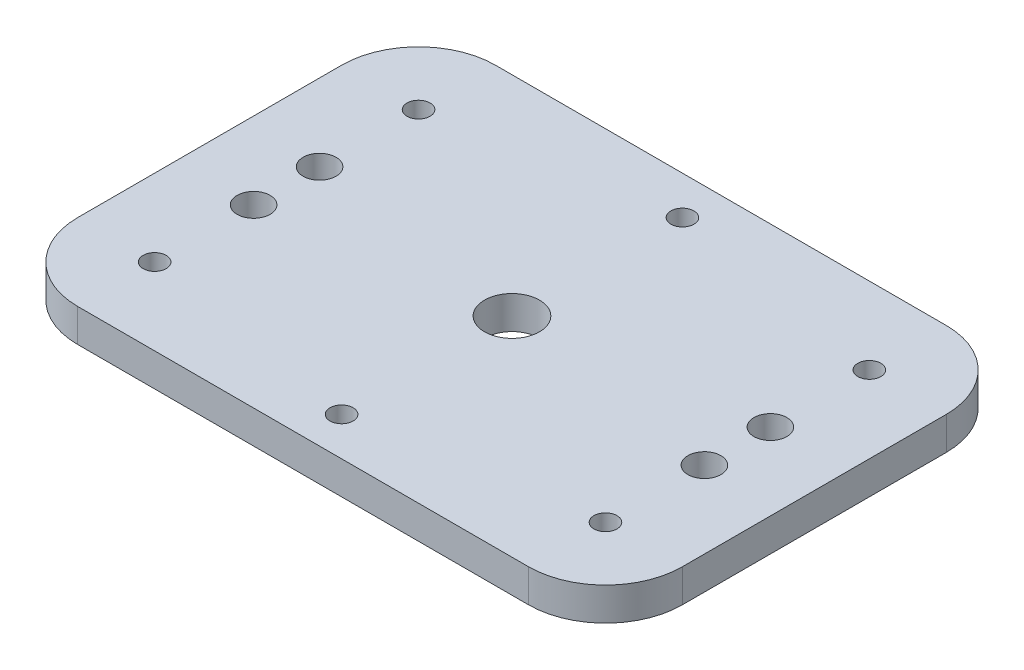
SolidWorks part; units mm, degrees
ref_plane "Front Plane" through (0, 0, 0) normal (0, 0, 1) x (1, 0, 0)
ref_plane "Top Plane" through (0, 0, 0) normal (0, 1, 0) x (1, 0, 0)
ref_plane "Right Plane" through (0, 0, 0) normal (1, 0, 0) x (0, 0, -1)
sketch "Sketch1" plane through (0, 0, 0) normal (0, 1, 0) x (1, 0, 0)
  line L0 (0, 38) -> (110, 38) construction
  line L1 (14, 0) -> (96, 0)
  line L2 (0, 14) -> (0, 62)
  line L3 (14, 76) -> (96, 76)
  line L4 (110, 14) -> (110, 62)
  line L5 (14, 62) -> (14, 44) construction
  line L6 (14, 44) -> (14, 32) construction
  line L7 (14, 32) -> (14, 14) construction
  line L8 (96, 62) -> (96, 44) construction
  line L9 (96, 44) -> (96, 32) construction
  line L10 (96, 32) -> (96, 14) construction
  line L11 (55, 76) -> (55, 0) construction
  line L12 (14, 44) -> (96, 44) construction
  line L13 (14, 32) -> (96, 32) construction
  arc A0 (110, 62) -> (96, 76) centre (96, 62) ccw
  arc A1 (96, 0) -> (110, 14) centre (96, 14) ccw
  arc A2 (0, 14) -> (14, 0) centre (14, 14) ccw
  arc A3 (0, 62) -> (14, 76) centre (14, 62) cw
  circle A4 centre (55, 38) radius 5
  circle A5 centre (14, 44) radius 3
  circle A6 centre (14, 32) radius 3
  circle A7 centre (96, 44) radius 3
  circle A8 centre (96, 32) radius 3
  point P7 (110, 76)
  point P12 (0, 0)
  point P15 (0, 76)
  dimension "D3" = 14
  dimension "D4" = 10
  dimension "D5" = 6
  dimension "D6" = 6
  dimension "D7" = 6
  dimension "D1" = 110
  dimension "D2" = 76
extrude "Extrude1" add sketch "Sketch1" along normal blind 6
sketch "Sketch3" plane through (0, 6, 0) normal (0, 1, 0) x (1, 0, 0)
  line L0 (55, 76) -> (55, 0) construction
  line L1 (96, 76) -> (14, 76) construction
  line L2 (14, 0) -> (96, 0) construction
  point P6 (55, 69)
  point P7 (55, 7)
  point P8 (96, 14)
  point P9 (96, 62)
  point P11 (14, 62)
  point P13 (14, 14)
  dimension "D1" = 7
  dimension "D2" = 7
hole_wizard "M5 Tapped Hole1" positions "3DSketch2" profile "Sketch6" tap size "M5" standard "ISO"
sketch3d "3DSketch2"
  line L0 (14, 6, -62) -> (14, 0, -62) construction
  point P0 (14, 6, -62)
  point P4 (55, 6, -69)
  point P7 (96, 6, -62)
  point P10 (96, 6, -14)
  point P13 (55, 6, -7)
  point P16 (14, 6, -14)
sketch "Sketch6" plane through (14, 6, -62) normal (1, 0, 0) x (0, 0, 1)
  line L0 (0, 0) -> (0, 6)
  line L1 (0, 6) -> (2.1, 6)
  line L2 (2.1, 6) -> (2.1, 0)
  line L5 (2.1, 0) -> (0, 0)
  line L11 (0, -6.35) -> (0, 107.95) construction
  dimension "Thru Tap Drill Dia." = 4.2
  dimension "Thru Tap Drill Depth" = 6
